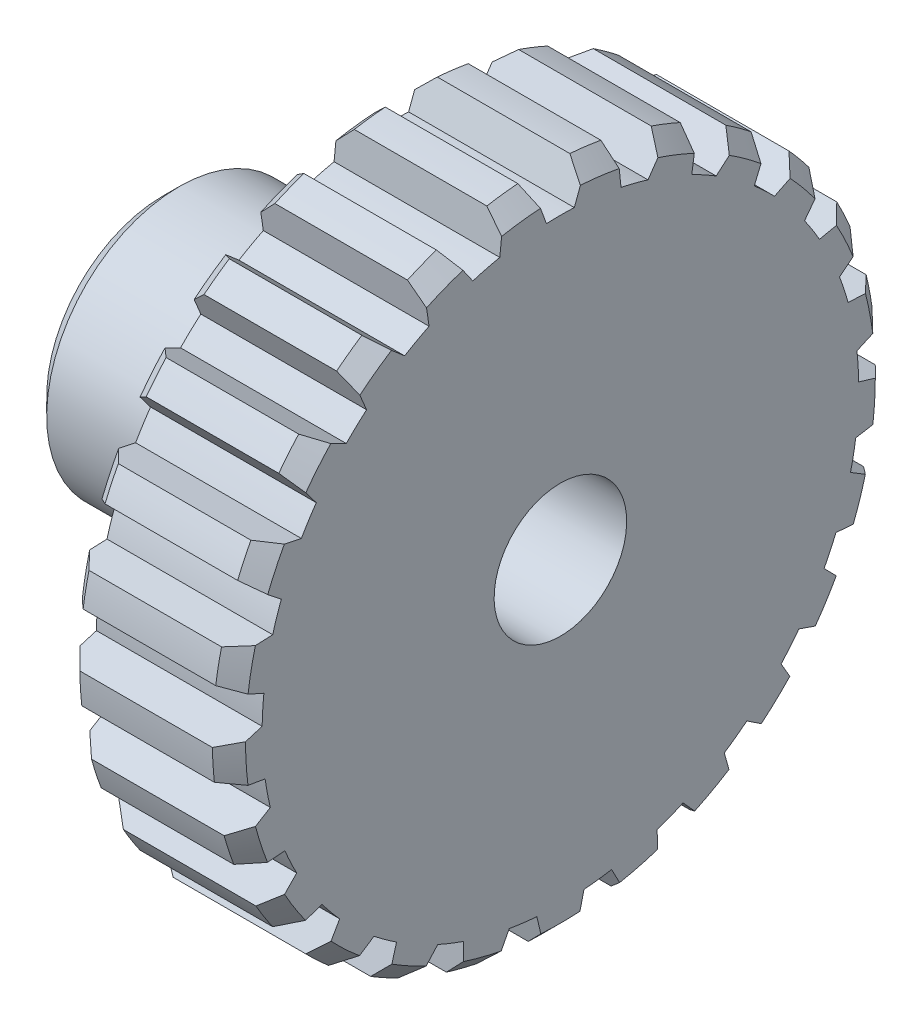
SolidWorks part; units mm, degrees
ref_plane "Front" through (0, 0, 0) normal (0, 0, 1) x (1, 0, 0)
ref_plane "Top" through (0, 0, 0) normal (0, 1, 0) x (1, 0, 0)
ref_plane "Right" through (0, 0, 0) normal (1, 0, 0) x (0, 0, -1)
sketch "Sketch1" plane through (0, 0, 0) normal (0, 0, 1) x (1, 0, 0)
  line L0 (0, 0) -> (-12, 0)
  line L1 (-12, 2) -> (-12, 4)
  line L2 (-12, 4) -> (-5, 4)
  line L3 (-5, 4) -> (-5, 10)
  line L4 (-5, 10) -> (0, 10)
  line L5 (0, 10) -> (0, 2)
  line L6 (0, 2) -> (-12, 2)
  dimension "D1" = 10
  dimension "D2" = 4
  dimension "D3" = 12
  dimension "D4" = 7
revolve "Revolve1" add sketch "Sketch1" angle 360 about L0
sketch "Sketch3" plane through (0, 0, 0) normal (1, 0, 0) x (0, 0, -1)
  line L0 (-0.785, 9.9691) -> (-0.42, 8.9902)
  line L1 (0.785, 9.9691) -> (0.785, 10.7794)
  line L2 (1.9204, 10.636) -> (1.7189, 9.8512)
  line L3 (-0.785, 10.7794) -> (-0.785, 9.9691)
  line L4 (1.7189, 9.8512) -> (1.829, 8.8122)
  line L5 (0.42, 8.9902) -> (0.785, 9.9691)
  line L6 (2.6426, 8.6033) -> (3.2396, 9.4607)
  line L7 (3.2396, 9.4607) -> (3.4411, 10.2455)
  line L8 (4.5051, 9.8243) -> (4.1148, 9.1142)
  line L9 (4.1148, 9.1142) -> (3.963, 8.0805)
  line L10 (4.6991, 7.6758) -> (5.4906, 8.3578)
  line L11 (5.4906, 8.3578) -> (5.8809, 9.0679)
  line L12 (6.8068, 8.3952) -> (6.2521, 7.8046)
  line L13 (6.2521, 7.8046) -> (5.848, 6.8411)
  line L14 (6.4604, 6.2661) -> (7.3966, 6.7298)
  line L15 (7.3966, 6.7298) -> (7.9513, 7.3205)
  line L16 (8.6807, 6.4387) -> (7.9966, 6.0045)
  line L17 (7.9966, 6.0045) -> (7.3656, 5.1718)
  line L18 (7.8157, 4.4626) -> (8.8378, 4.6789)
  line L19 (8.8378, 4.6789) -> (9.522, 5.1131)
  line L20 (10.0093, 4.0776) -> (9.2386, 3.8272)
  line L21 (9.2386, 3.8272) -> (8.4204, 3.1776)
  line L22 (8.68, 2.3787) -> (9.7238, 2.3341)
  line L23 (9.7238, 2.3341) -> (10.4944, 2.5844)
  line L24 (10.7089, 1.4603) -> (9.9002, 1.4094)
  line L25 (9.9002, 1.4094) -> (8.9461, 0.9837)
  line L26 (8.9988, 0.1453) -> (9.9988, -0.1575)
  line L27 (9.9988, -0.1575) -> (10.8074, -0.1066)
  line L28 (10.7356, -1.2488) -> (9.9397, -1.0969)
  line L29 (9.9397, -1.0969) -> (8.9097, -1.272)
  line L30 (8.7523, -2.0972) -> (9.6455, -2.6391)
  line L31 (9.6455, -2.6391) -> (10.4414, -2.791)
  line L32 (10.0878, -3.8794) -> (9.3546, -3.5344)
  line L33 (9.3546, -3.5344) -> (8.3134, -3.4478)
  line L34 (7.9557, -4.2079) -> (8.6861, -4.9549)
  line L35 (8.6861, -4.9549) -> (9.4193, -5.2999)
  line L36 (8.8061, -6.2662) -> (8.1817, -5.7497)
  line L37 (8.1817, -5.7497) -> (7.1948, -5.407)
  line L38 (6.6593, -6.0542) -> (7.181, -6.9594)
  line L39 (7.181, -6.9594) -> (7.8053, -7.4759)
  line L40 (6.9711, -8.2593) -> (6.4948, -7.6038)
  line L41 (6.4948, -7.6038) -> (5.6241, -7.0264)
  line L42 (4.9445, -7.5201) -> (5.2246, -8.5266)
  line L43 (5.2246, -8.5266) -> (5.7009, -9.1821)
  line L44 (4.698, -9.7335) -> (4.3998, -8.9801)
  line L45 (4.3998, -8.9801) -> (3.7, -8.2043)
  line L46 (2.919, -8.5135) -> (2.94, -9.5581)
  line L47 (2.94, -9.5581) -> (3.2383, -10.3114)
  line L48 (2.1298, -10.596) -> (2.0283, -9.7921)
  line L49 (2.0283, -9.7921) -> (1.5435, -8.8667)
  line L50 (0.7101, -8.9719) -> (0.4707, -9.9889)
  line L51 (0.4707, -9.9889) -> (0.5722, -10.7928)
  line L52 (-0.5722, -10.7928) -> (-0.4707, -9.9889)
  line L53 (-0.4707, -9.9889) -> (-0.7101, -8.9719)
  line L54 (-1.5435, -8.8667) -> (-2.0283, -9.7921)
  line L55 (-2.0283, -9.7921) -> (-2.1298, -10.596)
  line L56 (-3.2383, -10.3114) -> (-2.94, -9.5581)
  line L57 (-2.94, -9.5581) -> (-2.919, -8.5135)
  line L58 (-3.7, -8.2043) -> (-4.3998, -8.9801)
  line L59 (-4.3998, -8.9801) -> (-4.698, -9.7335)
  line L60 (-5.7009, -9.1821) -> (-5.2246, -8.5266)
  line L61 (-5.2246, -8.5266) -> (-4.9445, -7.5201)
  line L62 (-5.6241, -7.0264) -> (-6.4948, -7.6038)
  line L63 (-6.4948, -7.6038) -> (-6.9711, -8.2593)
  line L64 (-7.8053, -7.4759) -> (-7.181, -6.9594)
  line L65 (-7.181, -6.9594) -> (-6.6593, -6.0542)
  line L66 (-7.1948, -5.407) -> (-8.1817, -5.7497)
  line L67 (-8.1817, -5.7497) -> (-8.8061, -6.2662)
  line L68 (-9.4193, -5.2999) -> (-8.6861, -4.9549)
  line L69 (-8.6861, -4.9549) -> (-7.9557, -4.2079)
  line L70 (-8.3134, -3.4478) -> (-9.3546, -3.5344)
  line L71 (-9.3546, -3.5344) -> (-10.0878, -3.8794)
  line L72 (-10.4414, -2.791) -> (-9.6455, -2.6391)
  line L73 (-9.6455, -2.6391) -> (-8.7523, -2.0972)
  line L74 (-8.9097, -1.272) -> (-9.9397, -1.0969)
  line L75 (-9.9397, -1.0969) -> (-10.7356, -1.2488)
  line L76 (-10.8074, -0.1066) -> (-9.9988, -0.1575)
  line L77 (-9.9988, -0.1575) -> (-8.9988, 0.1453)
  line L78 (-8.9461, 0.9837) -> (-9.9002, 1.4094)
  line L79 (-9.9002, 1.4094) -> (-10.7089, 1.4603)
  line L80 (-10.4944, 2.5844) -> (-9.7238, 2.3341)
  line L81 (-9.7238, 2.3341) -> (-8.68, 2.3787)
  line L82 (-8.4204, 3.1776) -> (-9.2386, 3.8272)
  line L83 (-9.2386, 3.8272) -> (-10.0093, 4.0776)
  line L84 (-9.522, 5.1131) -> (-8.8378, 4.6789)
  line L85 (-8.8378, 4.6789) -> (-7.8157, 4.4626)
  line L86 (-7.3656, 5.1718) -> (-7.9966, 6.0045)
  line L87 (-7.9966, 6.0045) -> (-8.6807, 6.4387)
  line L88 (-7.9513, 7.3205) -> (-7.3966, 6.7298)
  line L89 (-7.3966, 6.7298) -> (-6.4604, 6.2661)
  line L90 (-5.848, 6.8411) -> (-6.2521, 7.8046)
  line L91 (-6.2521, 7.8046) -> (-6.8068, 8.3952)
  line L92 (-5.8809, 9.0679) -> (-5.4906, 8.3578)
  line L93 (-5.4906, 8.3578) -> (-4.6991, 7.6758)
  line L94 (-3.963, 8.0805) -> (-4.1148, 9.1142)
  line L95 (-4.1148, 9.1142) -> (-4.5051, 9.8243)
  line L96 (-3.4411, 10.2455) -> (-3.2396, 9.4607)
  line L97 (-3.2396, 9.4607) -> (-2.6426, 8.6033)
  line L98 (-1.829, 8.8122) -> (-1.7189, 9.8512)
  line L99 (-1.7189, 9.8512) -> (-1.9204, 10.636)
  arc A0 (3.4411, 10.2455) -> (1.9204, 10.636) centre (0, 0) ccw
  arc A1 (0.42, 8.9902) -> (-0.42, 8.9902) centre (0, 0) ccw
  arc A2 (0.785, 10.7794) -> (-0.785, 10.7794) centre (0, 0) ccw
  arc A3 (2.6426, 8.6033) -> (1.829, 8.8122) centre (0, 0) ccw
  arc A4 (5.8809, 9.0679) -> (4.5051, 9.8243) centre (0, 0) ccw
  arc A5 (4.6991, 7.6758) -> (3.963, 8.0805) centre (0, 0) ccw
  arc A6 (7.9513, 7.3205) -> (6.8068, 8.3952) centre (0, 0) ccw
  arc A7 (6.4604, 6.2661) -> (5.848, 6.8411) centre (0, 0) ccw
  arc A8 (9.522, 5.1131) -> (8.6807, 6.4387) centre (0, 0) ccw
  arc A9 (7.8157, 4.4626) -> (7.3656, 5.1718) centre (0, 0) ccw
  arc A10 (10.4944, 2.5844) -> (10.0093, 4.0776) centre (0, 0) ccw
  arc A11 (8.68, 2.3787) -> (8.4204, 3.1776) centre (0, 0) ccw
  arc A12 (10.8074, -0.1066) -> (10.7089, 1.4603) centre (0, 0) ccw
  arc A13 (8.9988, 0.1453) -> (8.9461, 0.9837) centre (0, 0) ccw
  arc A14 (10.4414, -2.791) -> (10.7356, -1.2488) centre (0, 0) ccw
  arc A15 (8.7523, -2.0972) -> (8.9097, -1.272) centre (0, 0) ccw
  arc A16 (9.4193, -5.2999) -> (10.0878, -3.8794) centre (0, 0) ccw
  arc A17 (7.9557, -4.2079) -> (8.3134, -3.4478) centre (0, 0) ccw
  arc A18 (7.8053, -7.4759) -> (8.8061, -6.2662) centre (0, 0) ccw
  arc A19 (6.6593, -6.0542) -> (7.1948, -5.407) centre (0, 0) ccw
  arc A20 (5.7009, -9.1821) -> (6.9711, -8.2593) centre (0, 0) ccw
  arc A21 (4.9445, -7.5201) -> (5.6241, -7.0264) centre (0, 0) ccw
  arc A22 (3.2383, -10.3114) -> (4.698, -9.7335) centre (0, 0) ccw
  arc A23 (2.919, -8.5135) -> (3.7, -8.2043) centre (0, 0) ccw
  arc A24 (0.5722, -10.7928) -> (2.1298, -10.596) centre (0, 0) ccw
  arc A25 (0.7101, -8.9719) -> (1.5435, -8.8667) centre (0, 0) ccw
  arc A26 (-2.1298, -10.596) -> (-0.5722, -10.7928) centre (0, 0) ccw
  arc A27 (-1.5435, -8.8667) -> (-0.7101, -8.9719) centre (0, 0) ccw
  arc A28 (-4.698, -9.7335) -> (-3.2383, -10.3114) centre (0, 0) ccw
  arc A29 (-3.7, -8.2043) -> (-2.919, -8.5135) centre (0, 0) ccw
  arc A30 (-6.9711, -8.2593) -> (-5.7009, -9.1821) centre (0, 0) ccw
  arc A31 (-5.6241, -7.0264) -> (-4.9445, -7.5201) centre (0, 0) ccw
  arc A32 (-8.8061, -6.2662) -> (-7.8053, -7.4759) centre (0, 0) ccw
  arc A33 (-7.1948, -5.407) -> (-6.6593, -6.0542) centre (0, 0) ccw
  arc A34 (-10.0878, -3.8794) -> (-9.4193, -5.2999) centre (0, 0) ccw
  arc A35 (-8.3134, -3.4478) -> (-7.9557, -4.2079) centre (0, 0) ccw
  arc A36 (-10.7356, -1.2488) -> (-10.4414, -2.791) centre (0, 0) ccw
  arc A37 (-8.9097, -1.272) -> (-8.7523, -2.0972) centre (0, 0) ccw
  arc A38 (-10.7089, 1.4603) -> (-10.8074, -0.1066) centre (0, 0) ccw
  arc A39 (-8.9461, 0.9837) -> (-8.9988, 0.1453) centre (0, 0) ccw
  arc A40 (-10.0093, 4.0776) -> (-10.4944, 2.5844) centre (0, 0) ccw
  arc A41 (-8.4204, 3.1776) -> (-8.68, 2.3787) centre (0, 0) ccw
  arc A42 (-8.6807, 6.4387) -> (-9.522, 5.1131) centre (0, 0) ccw
  arc A43 (-7.3656, 5.1718) -> (-7.8157, 4.4626) centre (0, 0) ccw
  arc A44 (-6.8068, 8.3952) -> (-7.9513, 7.3205) centre (0, 0) ccw
  arc A45 (-5.848, 6.8411) -> (-6.4604, 6.2661) centre (0, 0) ccw
  arc A46 (-4.5051, 9.8243) -> (-5.8809, 9.0679) centre (0, 0) ccw
  arc A47 (-3.963, 8.0805) -> (-4.6991, 7.6758) centre (0, 0) ccw
  arc A48 (-1.9204, 10.636) -> (-3.4411, 10.2455) centre (0, 0) ccw
  arc A49 (-1.829, 8.8122) -> (-2.6426, 8.6033) centre (0, 0) ccw
chamfer "Chamfer4" distance 0.5 angle 45 3 edges at (0, 10, 0) (-5, 10, 0) (-12, 4, 0)
extrude "Cut-Extrude2" cut sketch "Sketch3" against normal blind 10
scale "Scale3" bodies to scale 103 scale about origin uniform scaling yes scale factor 1.25
